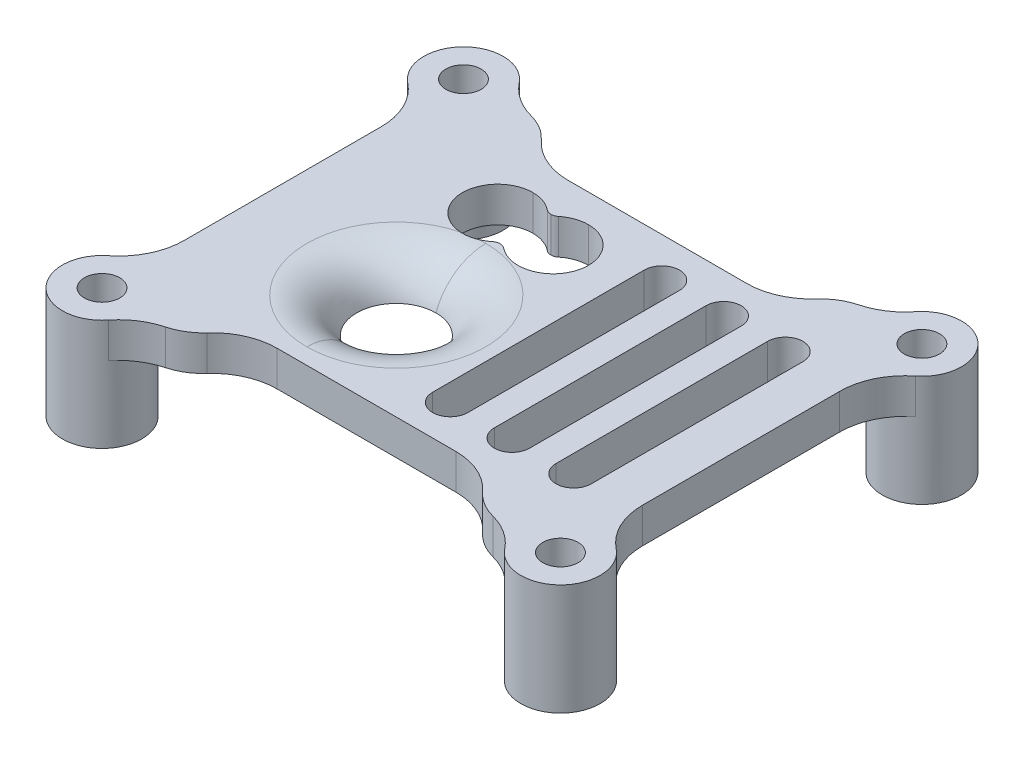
SolidWorks part; units mm, degrees
other "Fillet6"
ref_plane "Front Plane" through (0, 0, 0) normal (0, 0, 1) x (1, 0, 0)
ref_plane "Top Plane" through (0, 0, 0) normal (0, 1, 0) x (1, 0, 0)
ref_plane "Right Plane" through (0, 0, 0) normal (1, 0, 0) x (0, 0, -1)
imported_body "MTF-02P AIO Cover.STEP<1>"
sketch "Sketch1" plane through (0, 0, 0) normal (0, -1, 0) x (1, 0, 0)
  circle A0 centre (-13, 10.25) radius 2.25
  circle A1 centre (-13, 10.25) radius 0.95
  dimension "D1" = 4.5
  dimension "D2" = 1.9
extrude "Boss-Extrude1" add sketch "Sketch1" along normal blind 4.3
mirror "Mirror1" about plane through (0, 0, 0) normal (0, 0, 1) of "Boss-Extrude1"
hole_wizard "Ø2.0 (2) Diameter Hole1" positions "Sketch3" profile "Sketch5" hole size "Ø2.0" standard "ANSI Metric"
sketch "Sketch3" plane through (0, -4.3, 0) normal (0, -1, 0) x (-1, 0, 0)
  point P0 (13, -10.25)
  point P3 (13, 10.25)
  point P6 (-13, 10.25)
  point P9 (-13, -10.25)
sketch "Sketch5" plane through (-13, -4.3, 10.25) normal (1, 0, 0) x (0, 0, -1)
  line L0 (0, 0) -> (0, 6.3025)
  line L1 (0, 6.3025) -> (1, 6.3025)
  line L2 (1, 6.3025) -> (1, 0.025)
  line L3 (1, 0.025) -> (1.025, 0)
  line L5 (1.025, 0) -> (0, 0)
  line L6 (-1, 0.025) -> (-1.025, 0) construction
  line L11 (0, -6.35) -> (0, 107.95) construction
  dimension "Thru Hole Dia." = 2
  dimension "Thru Hole Depth" = 6.3025
  dimension "Near C'Sink Dia." = 2.05
  dimension "Near C'Sink Angle" = 90
